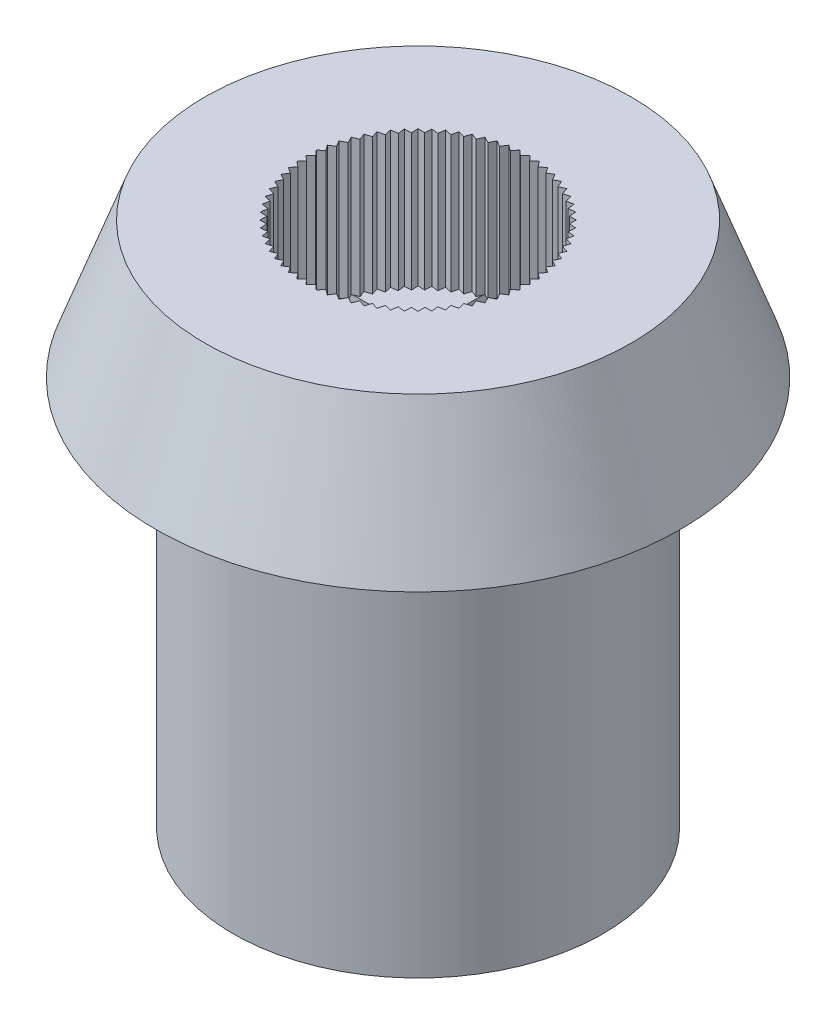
SolidWorks part; units mm, degrees
ref_plane "Ebene vorne" through (0, 0, 0) normal (0, 0, 1) x (1, 0, 0)
ref_plane "Ebene oben" through (0, 0, 0) normal (0, 1, 0) x (1, 0, 0)
ref_plane "Ebene rechts" through (0, 0, 0) normal (1, 0, 0) x (0, 0, -1)
sketch "Skizze1" plane through (0, 0, 0) normal (0, 0, 1) x (1, 0, 0)
  line L0 (0, 0) -> (0, 10.8461) construction
  line L1 (-2.3, 0) -> (-4.3809, 0)
  line L3 (-2.3, 0) -> (-2.3, -2.8)
  line L4 (-2.3, -2.8) -> (0, -2.8)
  line L5 (0, -2.8) -> (0, -10.8)
  line L6 (0, -10.8) -> (-3.8, -10.8)
  line L7 (-3.8, -10.8) -> (-3.8, -2.8)
  line L9 (-4.3809, 0) -> (-5.4, -2.8)
  line L10 (-5.4, -2.8) -> (-3.8, -2.8)
  dimension "D1" = 2.3
  dimension "D2" = 8
  dimension "D3" = 3.8
  dimension "D4" = 2.8
  dimension "D5" = 20
  dimension "D6" = 0
  dimension "D7" = 1.6
revolve "Rotation1" add sketch "Skizze1" angle 360 about L0
sketch "Skizze2" plane through (0, 0, 0) normal (0, 1, 0) x (1, 0, 0)
  line L0 (0, 0) -> (-2.3, 0) construction
  line L1 (0, 0) -> (-2.2912, 0.2005) construction
  line L2 (-2.2912, 0.2005) -> (-2.1979, 0.096)
  line L3 (-2.1979, 0.096) -> (-2.3, 0)
  line L4 (-2.1979, 0.096) -> (0, 0) construction
  line L5 (-2.1812, 0.2872) -> (-2.2912, 0.2005)
  line L6 (-2.2651, 0.3994) -> (-2.1812, 0.2872)
  line L7 (-2.1479, 0.4762) -> (-2.2651, 0.3994)
  line L8 (-2.2216, 0.5953) -> (-2.1479, 0.4762)
  line L9 (-2.0982, 0.6616) -> (-2.2216, 0.5953)
  line L10 (-2.1613, 0.7866) -> (-2.0982, 0.6616)
  line L11 (-2.0325, 0.8419) -> (-2.1613, 0.7866)
  line L12 (-2.0845, 0.972) -> (-2.0325, 0.8419)
  line L13 (-1.9514, 1.0158) -> (-2.0845, 0.972)
  line L14 (-1.9919, 1.15) -> (-1.9514, 1.0158)
  line L15 (-1.8555, 1.1821) -> (-1.9919, 1.15)
  line L16 (-1.884, 1.3192) -> (-1.8555, 1.1821)
  line L17 (-1.7454, 1.3393) -> (-1.884, 1.3192)
  line L18 (-1.7619, 1.4784) -> (-1.7454, 1.3393)
  line L19 (-1.622, 1.4863) -> (-1.7619, 1.4784)
  line L20 (-1.6263, 1.6263) -> (-1.622, 1.4863)
  line L21 (-1.4863, 1.622) -> (-1.6263, 1.6263)
  line L22 (-1.4784, 1.7619) -> (-1.4863, 1.622)
  line L23 (-1.3393, 1.7454) -> (-1.4784, 1.7619)
  line L24 (-1.3192, 1.884) -> (-1.3393, 1.7454)
  line L25 (-1.1821, 1.8555) -> (-1.3192, 1.884)
  line L26 (-1.15, 1.9919) -> (-1.1821, 1.8555)
  line L27 (-1.0158, 1.9514) -> (-1.15, 1.9919)
  line L28 (-0.972, 2.0845) -> (-1.0158, 1.9514)
  line L29 (-0.8419, 2.0325) -> (-0.972, 2.0845)
  line L30 (-0.7866, 2.1613) -> (-0.8419, 2.0325)
  line L31 (-0.6616, 2.0982) -> (-0.7866, 2.1613)
  line L32 (-0.5953, 2.2216) -> (-0.6616, 2.0982)
  line L33 (-0.4762, 2.1479) -> (-0.5953, 2.2216)
  line L34 (-0.3994, 2.2651) -> (-0.4762, 2.1479)
  line L35 (-0.2872, 2.1812) -> (-0.3994, 2.2651)
  line L36 (-0.2005, 2.2912) -> (-0.2872, 2.1812)
  line L37 (-0.096, 2.1979) -> (-0.2005, 2.2912)
  line L38 (0, 2.3) -> (-0.096, 2.1979)
  line L39 (0.096, 2.1979) -> (0, 2.3)
  line L40 (0.2005, 2.2912) -> (0.096, 2.1979)
  line L41 (0.2872, 2.1812) -> (0.2005, 2.2912)
  line L42 (0.3994, 2.2651) -> (0.2872, 2.1812)
  line L43 (0.4762, 2.1479) -> (0.3994, 2.2651)
  line L44 (0.5953, 2.2216) -> (0.4762, 2.1479)
  line L45 (0.6616, 2.0982) -> (0.5953, 2.2216)
  line L46 (0.7866, 2.1613) -> (0.6616, 2.0982)
  line L47 (0.8419, 2.0325) -> (0.7866, 2.1613)
  line L48 (0.972, 2.0845) -> (0.8419, 2.0325)
  line L49 (1.0158, 1.9514) -> (0.972, 2.0845)
  line L50 (1.15, 1.9919) -> (1.0158, 1.9514)
  line L51 (1.1821, 1.8555) -> (1.15, 1.9919)
  line L52 (1.3192, 1.884) -> (1.1821, 1.8555)
  line L53 (1.3393, 1.7454) -> (1.3192, 1.884)
  line L54 (1.4784, 1.7619) -> (1.3393, 1.7454)
  line L55 (1.4863, 1.622) -> (1.4784, 1.7619)
  line L56 (1.6263, 1.6263) -> (1.4863, 1.622)
  line L57 (1.622, 1.4863) -> (1.6263, 1.6263)
  line L58 (1.7619, 1.4784) -> (1.622, 1.4863)
  line L59 (1.7454, 1.3393) -> (1.7619, 1.4784)
  line L60 (1.884, 1.3192) -> (1.7454, 1.3393)
  line L61 (1.8555, 1.1821) -> (1.884, 1.3192)
  line L62 (1.9919, 1.15) -> (1.8555, 1.1821)
  line L63 (1.9514, 1.0158) -> (1.9919, 1.15)
  line L64 (2.0845, 0.972) -> (1.9514, 1.0158)
  line L65 (2.0325, 0.8419) -> (2.0845, 0.972)
  line L66 (2.1613, 0.7866) -> (2.0325, 0.8419)
  line L67 (2.0982, 0.6616) -> (2.1613, 0.7866)
  line L68 (2.2216, 0.5953) -> (2.0982, 0.6616)
  line L69 (2.1479, 0.4762) -> (2.2216, 0.5953)
  line L70 (2.2651, 0.3994) -> (2.1479, 0.4762)
  line L71 (2.1812, 0.2872) -> (2.2651, 0.3994)
  line L72 (2.2912, 0.2005) -> (2.1812, 0.2872)
  line L73 (2.1979, 0.096) -> (2.2912, 0.2005)
  line L74 (2.3, 0) -> (2.1979, 0.096)
  line L75 (2.1979, -0.096) -> (2.3, 0)
  line L76 (2.2912, -0.2005) -> (2.1979, -0.096)
  line L77 (2.1812, -0.2872) -> (2.2912, -0.2005)
  line L78 (2.2651, -0.3994) -> (2.1812, -0.2872)
  line L79 (2.1479, -0.4762) -> (2.2651, -0.3994)
  line L80 (2.2216, -0.5953) -> (2.1479, -0.4762)
  line L81 (2.0982, -0.6616) -> (2.2216, -0.5953)
  line L82 (2.1613, -0.7866) -> (2.0982, -0.6616)
  line L83 (2.0325, -0.8419) -> (2.1613, -0.7866)
  line L84 (2.0845, -0.972) -> (2.0325, -0.8419)
  line L85 (1.9514, -1.0158) -> (2.0845, -0.972)
  line L86 (1.9919, -1.15) -> (1.9514, -1.0158)
  line L87 (1.8555, -1.1821) -> (1.9919, -1.15)
  line L88 (1.884, -1.3192) -> (1.8555, -1.1821)
  line L89 (1.7454, -1.3393) -> (1.884, -1.3192)
  line L90 (1.7619, -1.4784) -> (1.7454, -1.3393)
  line L91 (1.622, -1.4863) -> (1.7619, -1.4784)
  line L92 (1.6263, -1.6263) -> (1.622, -1.4863)
  line L93 (1.4863, -1.622) -> (1.6263, -1.6263)
  line L94 (1.4784, -1.7619) -> (1.4863, -1.622)
  line L95 (1.3393, -1.7454) -> (1.4784, -1.7619)
  line L96 (1.3192, -1.884) -> (1.3393, -1.7454)
  line L97 (1.1821, -1.8555) -> (1.3192, -1.884)
  line L98 (1.15, -1.9919) -> (1.1821, -1.8555)
  line L99 (1.0158, -1.9514) -> (1.15, -1.9919)
  line L100 (0.972, -2.0845) -> (1.0158, -1.9514)
  line L101 (0.8419, -2.0325) -> (0.972, -2.0845)
  line L102 (0.7866, -2.1613) -> (0.8419, -2.0325)
  line L103 (0.6616, -2.0982) -> (0.7866, -2.1613)
  line L104 (0.5953, -2.2216) -> (0.6616, -2.0982)
  line L105 (0.4762, -2.1479) -> (0.5953, -2.2216)
  line L106 (0.3994, -2.2651) -> (0.4762, -2.1479)
  line L107 (0.2872, -2.1812) -> (0.3994, -2.2651)
  line L108 (0.2005, -2.2912) -> (0.2872, -2.1812)
  line L109 (0.096, -2.1979) -> (0.2005, -2.2912)
  line L110 (0, -2.3) -> (0.096, -2.1979)
  line L111 (-0.096, -2.1979) -> (0, -2.3)
  line L112 (-0.2005, -2.2912) -> (-0.096, -2.1979)
  line L113 (-0.2872, -2.1812) -> (-0.2005, -2.2912)
  line L114 (-0.3994, -2.2651) -> (-0.2872, -2.1812)
  line L115 (-0.4762, -2.1479) -> (-0.3994, -2.2651)
  line L116 (-0.5953, -2.2216) -> (-0.4762, -2.1479)
  line L117 (-0.6616, -2.0982) -> (-0.5953, -2.2216)
  line L118 (-0.7866, -2.1613) -> (-0.6616, -2.0982)
  line L119 (-0.8419, -2.0325) -> (-0.7866, -2.1613)
  line L120 (-0.972, -2.0845) -> (-0.8419, -2.0325)
  line L121 (-1.0158, -1.9514) -> (-0.972, -2.0845)
  line L122 (-1.15, -1.9919) -> (-1.0158, -1.9514)
  line L123 (-1.1821, -1.8555) -> (-1.15, -1.9919)
  line L124 (-1.3192, -1.884) -> (-1.1821, -1.8555)
  line L125 (-1.3393, -1.7454) -> (-1.3192, -1.884)
  line L126 (-1.4784, -1.7619) -> (-1.3393, -1.7454)
  line L127 (-1.4863, -1.622) -> (-1.4784, -1.7619)
  line L128 (-1.6263, -1.6263) -> (-1.4863, -1.622)
  line L129 (-1.622, -1.4863) -> (-1.6263, -1.6263)
  line L130 (-1.7619, -1.4784) -> (-1.622, -1.4863)
  line L131 (-1.7454, -1.3393) -> (-1.7619, -1.4784)
  line L132 (-1.884, -1.3192) -> (-1.7454, -1.3393)
  line L133 (-1.8555, -1.1821) -> (-1.884, -1.3192)
  line L134 (-1.9919, -1.15) -> (-1.8555, -1.1821)
  line L135 (-1.9514, -1.0158) -> (-1.9919, -1.15)
  line L136 (-2.0845, -0.972) -> (-1.9514, -1.0158)
  line L137 (-2.0325, -0.8419) -> (-2.0845, -0.972)
  line L138 (-2.1613, -0.7866) -> (-2.0325, -0.8419)
  line L139 (-2.0982, -0.6616) -> (-2.1613, -0.7866)
  line L140 (-2.2216, -0.5953) -> (-2.0982, -0.6616)
  line L141 (-2.1479, -0.4762) -> (-2.2216, -0.5953)
  line L142 (-2.2651, -0.3994) -> (-2.1479, -0.4762)
  line L143 (-2.1812, -0.2872) -> (-2.2651, -0.3994)
  line L144 (-2.2912, -0.2005) -> (-2.1812, -0.2872)
  line L145 (-2.1979, -0.096) -> (-2.2912, -0.2005)
  line L146 (-2.3, 0) -> (-2.1979, -0.096)
  circle A0 centre (0, 0) radius 2.3 construction
  circle A1 centre (0, 0) radius 2.3 construction
  arc A2 (-2.2912, 0.2005) -> (-2.3, 0) centre (0, 0) ccw
  arc A3 (-2.2651, 0.3994) -> (-2.2912, 0.2005) centre (0, 0) ccw
  arc A4 (-2.2216, 0.5953) -> (-2.2651, 0.3994) centre (0, 0) ccw
  arc A5 (-2.1613, 0.7866) -> (-2.2216, 0.5953) centre (0, 0) ccw
  arc A6 (-2.0845, 0.972) -> (-2.1613, 0.7866) centre (0, 0) ccw
  arc A7 (-1.9919, 1.15) -> (-2.0845, 0.972) centre (0, 0) ccw
  arc A8 (-1.884, 1.3192) -> (-1.9919, 1.15) centre (0, 0) ccw
  arc A9 (-1.7619, 1.4784) -> (-1.884, 1.3192) centre (0, 0) ccw
  arc A10 (-1.6263, 1.6263) -> (-1.7619, 1.4784) centre (0, 0) ccw
  arc A11 (-1.4784, 1.7619) -> (-1.6263, 1.6263) centre (0, 0) ccw
  arc A12 (-1.3192, 1.884) -> (-1.4784, 1.7619) centre (0, 0) ccw
  arc A13 (-1.15, 1.9919) -> (-1.3192, 1.884) centre (0, 0) ccw
  arc A14 (-0.972, 2.0845) -> (-1.15, 1.9919) centre (0, 0) ccw
  arc A15 (-0.7866, 2.1613) -> (-0.972, 2.0845) centre (0, 0) ccw
  arc A16 (-0.5953, 2.2216) -> (-0.7866, 2.1613) centre (0, 0) ccw
  arc A17 (-0.3994, 2.2651) -> (-0.5953, 2.2216) centre (0, 0) ccw
  arc A18 (-0.2005, 2.2912) -> (-0.3994, 2.2651) centre (0, 0) ccw
  arc A19 (0, 2.3) -> (-0.2005, 2.2912) centre (0, 0) ccw
  arc A20 (0.2005, 2.2912) -> (0, 2.3) centre (0, 0) ccw
  arc A21 (0.3994, 2.2651) -> (0.2005, 2.2912) centre (0, 0) ccw
  arc A22 (0.5953, 2.2216) -> (0.3994, 2.2651) centre (0, 0) ccw
  arc A23 (0.7866, 2.1613) -> (0.5953, 2.2216) centre (0, 0) ccw
  arc A24 (0.972, 2.0845) -> (0.7866, 2.1613) centre (0, 0) ccw
  arc A25 (1.15, 1.9919) -> (0.972, 2.0845) centre (0, 0) ccw
  arc A26 (1.3192, 1.884) -> (1.15, 1.9919) centre (0, 0) ccw
  arc A27 (1.4784, 1.7619) -> (1.3192, 1.884) centre (0, 0) ccw
  arc A28 (1.6263, 1.6263) -> (1.4784, 1.7619) centre (0, 0) ccw
  arc A29 (1.7619, 1.4784) -> (1.6263, 1.6263) centre (0, 0) ccw
  arc A30 (1.884, 1.3192) -> (1.7619, 1.4784) centre (0, 0) ccw
  arc A31 (1.9919, 1.15) -> (1.884, 1.3192) centre (0, 0) ccw
  arc A32 (2.0845, 0.972) -> (1.9919, 1.15) centre (0, 0) ccw
  arc A33 (2.1613, 0.7866) -> (2.0845, 0.972) centre (0, 0) ccw
  arc A34 (2.2216, 0.5953) -> (2.1613, 0.7866) centre (0, 0) ccw
  arc A35 (2.2651, 0.3994) -> (2.2216, 0.5953) centre (0, 0) ccw
  arc A36 (2.2912, 0.2005) -> (2.2651, 0.3994) centre (0, 0) ccw
  arc A37 (2.3, 0) -> (2.2912, 0.2005) centre (0, 0) ccw
  arc A38 (2.2912, -0.2005) -> (2.3, 0) centre (0, 0) ccw
  arc A39 (2.2651, -0.3994) -> (2.2912, -0.2005) centre (0, 0) ccw
  arc A40 (2.2216, -0.5953) -> (2.2651, -0.3994) centre (0, 0) ccw
  arc A41 (2.1613, -0.7866) -> (2.2216, -0.5953) centre (0, 0) ccw
  arc A42 (2.0845, -0.972) -> (2.1613, -0.7866) centre (0, 0) ccw
  arc A43 (1.9919, -1.15) -> (2.0845, -0.972) centre (0, 0) ccw
  arc A44 (1.884, -1.3192) -> (1.9919, -1.15) centre (0, 0) ccw
  arc A45 (1.7619, -1.4784) -> (1.884, -1.3192) centre (0, 0) ccw
  arc A46 (1.6263, -1.6263) -> (1.7619, -1.4784) centre (0, 0) ccw
  arc A47 (1.4784, -1.7619) -> (1.6263, -1.6263) centre (0, 0) ccw
  arc A48 (1.3192, -1.884) -> (1.4784, -1.7619) centre (0, 0) ccw
  arc A49 (1.15, -1.9919) -> (1.3192, -1.884) centre (0, 0) ccw
  arc A50 (0.972, -2.0845) -> (1.15, -1.9919) centre (0, 0) ccw
  arc A51 (0.7866, -2.1613) -> (0.972, -2.0845) centre (0, 0) ccw
  arc A52 (0.5953, -2.2216) -> (0.7866, -2.1613) centre (0, 0) ccw
  arc A53 (0.3994, -2.2651) -> (0.5953, -2.2216) centre (0, 0) ccw
  arc A54 (0.2005, -2.2912) -> (0.3994, -2.2651) centre (0, 0) ccw
  arc A55 (0, -2.3) -> (0.2005, -2.2912) centre (0, 0) ccw
  arc A56 (-0.2005, -2.2912) -> (0, -2.3) centre (0, 0) ccw
  arc A57 (-0.3994, -2.2651) -> (-0.2005, -2.2912) centre (0, 0) ccw
  arc A58 (-0.5953, -2.2216) -> (-0.3994, -2.2651) centre (0, 0) ccw
  arc A59 (-0.7866, -2.1613) -> (-0.5953, -2.2216) centre (0, 0) ccw
  arc A60 (-0.972, -2.0845) -> (-0.7866, -2.1613) centre (0, 0) ccw
  arc A61 (-1.15, -1.9919) -> (-0.972, -2.0845) centre (0, 0) ccw
  arc A62 (-1.3192, -1.884) -> (-1.15, -1.9919) centre (0, 0) ccw
  arc A63 (-1.4784, -1.7619) -> (-1.3192, -1.884) centre (0, 0) ccw
  arc A64 (-1.6263, -1.6263) -> (-1.4784, -1.7619) centre (0, 0) ccw
  arc A65 (-1.7619, -1.4784) -> (-1.6263, -1.6263) centre (0, 0) ccw
  arc A66 (-1.884, -1.3192) -> (-1.7619, -1.4784) centre (0, 0) ccw
  arc A67 (-1.9919, -1.15) -> (-1.884, -1.3192) centre (0, 0) ccw
  arc A68 (-2.0845, -0.972) -> (-1.9919, -1.15) centre (0, 0) ccw
  arc A69 (-2.1613, -0.7866) -> (-2.0845, -0.972) centre (0, 0) ccw
  arc A70 (-2.2216, -0.5953) -> (-2.1613, -0.7866) centre (0, 0) ccw
  arc A71 (-2.2651, -0.3994) -> (-2.2216, -0.5953) centre (0, 0) ccw
  arc A72 (-2.2912, -0.2005) -> (-2.2651, -0.3994) centre (0, 0) ccw
  arc A73 (-2.3, 0) -> (-2.2912, -0.2005) centre (0, 0) ccw
  point P225 (0, 0)
other "AusrichtungGruppe1" parameters "D3"=4.6, "D4"=4.6, "D1"=2.3, "D2"=0.0916
extrude "Aufsatz-Linear austragen3" add sketch "Skizze2" against normal blind 2.8 contours L144 L143 M11 | L140 L139 M11 | L138 L137 M11 | L134 L133 M11 | L132 L131 M11 | L130 L129 M11 | L126 L125 M11 | L120 L119 M11 | L118 L117 M11 | L116 L115 M11 | L114 L113 M11 | L112 L111 M11 | L110 L109 M11 | L108 L107 M11 | L106 L105 M11 | L104 L103 M11 | L102 L101 M11 | L100 L99 M11 | L98 L97 M11 | L94 L93 M11 | L92 L91 M11 | L88 L87 M11 | L86 L85 M11 | L84 L83 M11 | L82 L81 M11 | L80 L79 M11 | L78 L77 M11 | L76 L75 M11 | L74 L73 M11 | L70 L69 M11 | L66 L65 M11 | L58 L57 M11 | L56 L55 M11 | L48 L47 M11 | L46 L45 M11 | L44 L43 M11 | L42 L41 M11 | L40 L39 M11 | L38 L37 M11 | L36 L35 M11 | L8 L7 M11 | L10 L9 M11 | L12 L11 M11 | L22 L21 M11 | L24 L23 M11 | L26 L25 M11 | L30 L29 M11 | L32 L31 M11 | L34 L33 M11 | L5 A3 L6 | A2 L3 L2 | A73 L145 L146 | A71 L141 L142 | L136 L135 A68 | L127 A64 L128 | L123 A62 L124 | L122 L121 A61 | L95 A48 L96 | L90 L89 A45 | A36 L71 L72 | L67 A34 L68 | L63 A32 L64 | L61 A31 L62 | L59 A30 L60 | L54 L53 A27 | L51 A26 L52 | L50 L49 A25 | L14 L13 A7 | L15 A8 L16 | L17 A9 L18 | L19 A10 L20 | L27 A14 L28
sketch "Skizze3" plane through (0, -10.8, 0) normal (0, -1, 0) x (1, 0, 0)
  line L0 (0, 0) -> (2.45, 0) construction
  line L1 (0, 0) -> (0, 2.45) construction
  line L2 (0, 2.45) -> (0.8, 2.45) construction
  line L3 (0.8, 2.3157) -> (0.8, 1.2)
  line L4 (1.2, 0.8) -> (2.3157, 0.8)
  line L5 (2.3157, -0.8) -> (1.2, -0.8)
  line L6 (0.8, -1.2) -> (0.8, -2.3157)
  line L7 (-0.8, -2.3157) -> (-0.8, -1.2)
  line L8 (-1.2, -0.8) -> (-2.3157, -0.8)
  line L9 (-2.3157, 0.8) -> (-1.2, 0.8)
  line L10 (-0.8, 1.2) -> (-0.8, 2.3157)
  arc A0 (-2.3157, 0.8) -> (-2.3157, -0.8) centre (0, 0) ccw
  arc A1 (0.8, 1.2) -> (1.2, 0.8) centre (1.2, 1.2) ccw
  arc A2 (1.2, -0.8) -> (0.8, -1.2) centre (1.2, -1.2) ccw
  arc A3 (-0.8, -1.2) -> (-1.2, -0.8) centre (-1.2, -1.2) ccw
  arc A4 (-1.2, 0.8) -> (-0.8, 1.2) centre (-1.2, 1.2) ccw
  arc A5 (0.8, 2.3157) -> (-0.8, 2.3157) centre (0, 0) ccw
  arc A6 (2.3157, -0.8) -> (2.3157, 0.8) centre (0, 0) ccw
  arc A7 (-0.8, -2.3157) -> (0.8, -2.3157) centre (0, 0) ccw
  point P29 (0, 0)
  dimension "D1" = 4.9
  dimension "D4" = 0.4
  dimension "D2" = 0.8
  dimension "D3" = 0.8
  dimension "D5" = 4
extrude "Schnitt-Linear austragen1" cut sketch "Skizze3" against normal blind 8
